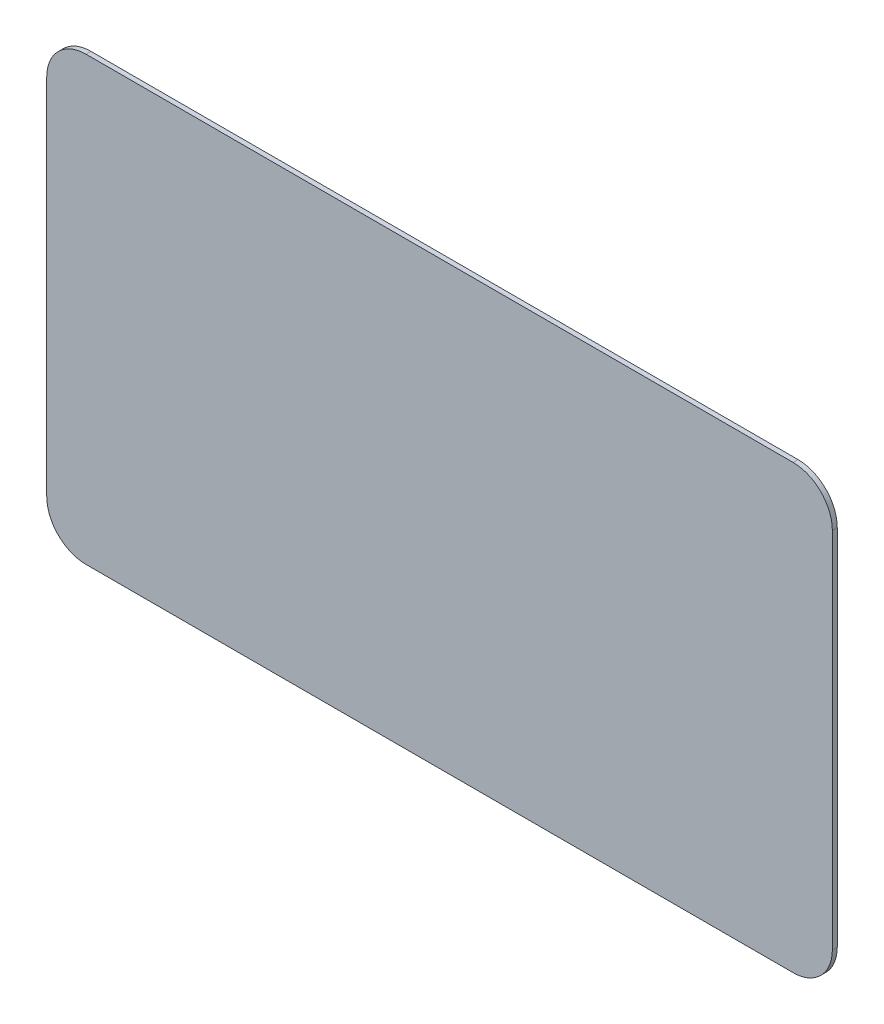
SolidWorks part; units mm, degrees
ref_plane "Ebene vorne" through (0, 0, 0) normal (0, 0, 1) x (1, 0, 0)
ref_plane "Ebene oben" through (0, 0, 0) normal (0, 1, 0) x (1, 0, 0)
ref_plane "Ebene rechts" through (0, 0, 0) normal (1, 0, 0) x (0, 0, -1)
sketch "Skizze1" plane through (0, 0, 0) normal (0, 0, 1) x (1, 0, 0)
  line L1 (-40, -22.5) -> (40, -22.5)
  line L2 (-40, -22.5) -> (-40, 22.5)
  line L3 (-40, 22.5) -> (40, 22.5)
  line L4 (40, -22.5) -> (40, 22.5)
  line L5 (0, 22.5) -> (0, -22.5) construction
  line L6 (-40, 0) -> (40, 0) construction
  point P104 (0, 0)
  dimension "D1" = 80
  dimension "D2" = 45
extrude "Aufsatz-Linear austragen1" add sketch "Skizze1" along normal blind 0.5
fillet "Verrundung1" radius 4 4 edges at (40, 22.5, 0.25) (40, -22.5, 0.25) (-40, -22.5, 0.25) (-40, 22.5, 0.25)
